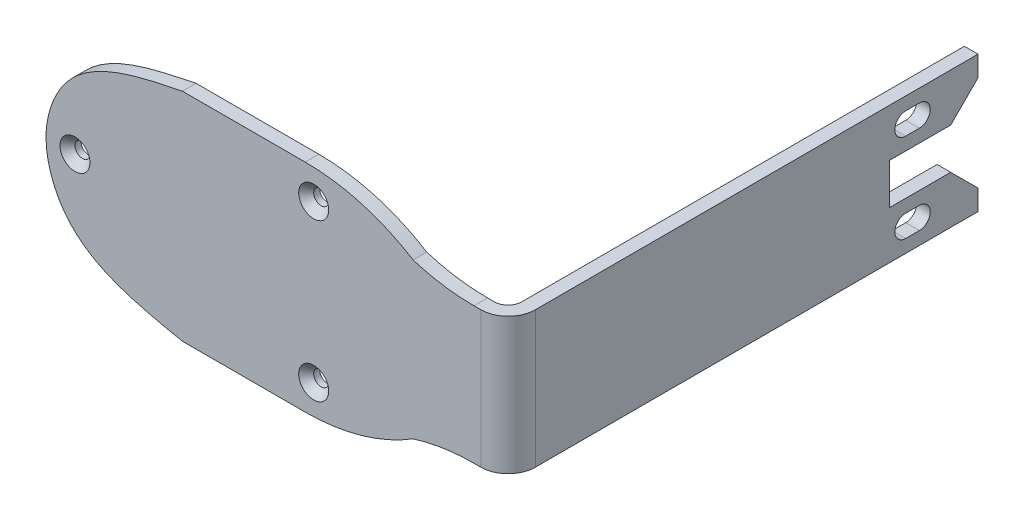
SolidWorks part; units mm, degrees
ref_plane "Face" through (0, 0, 0) normal (0, 0, 1) x (1, 0, 0)
ref_plane "Dessus" through (0, 0, 0) normal (0, 1, 0) x (1, 0, 0)
ref_plane "Droite" through (0, 0, 0) normal (1, 0, 0) x (0, 0, -1)
sketch "Esquisse1" plane through (0, 0, 0) normal (0, 0, 1) x (1, 0, 0)
  line L0 (-170.0705, 12.111) -> (-178.0705, 12.111)
  line L1 (-135.3205, 17.986) -> (-140.3138, 17.986)
  line L2 (-170.0705, 43.861) -> (-178.0705, 43.861)
  line L4 (-32.3132, 27.986) -> (-241.3155, 27.986) construction
  line L5 (-165.0705, 12.111) -> (-170.0705, 12.111)
  line L7 (-203.0705, 27.986) -> (-203.0705, 52.7894) construction
  line L10 (-183.0705, 43.861) -> (-178.0705, 43.861)
  line L12 (-183.0705, 12.111) -> (-178.0705, 12.111)
  line L13 (-135.3205, 37.986) -> (-135.3205, 17.986)
  line L18 (-165.0705, 43.861) -> (-170.0705, 43.861)
  line L21 (-135.3205, 37.986) -> (-140.3138, 37.986)
  arc A0 (-140.3138, 17.986) -> (-149.2415, 16.6268) centre (-140.3138, -12.014) ccw
  arc A1 (-149.2415, 16.6268) -> (-165.0705, 12.111) centre (-165.0705, 42.111) cw
  arc A2 (-149.2415, 39.3452) -> (-165.0705, 43.861) centre (-165.0705, 13.861) ccw
  arc A3 (-140.3138, 37.986) -> (-149.2415, 39.3452) centre (-140.3138, 67.986) cw
  point P11 (-200.4537, 19.986)
  point P21 (-200.4537, 35.986)
  dimension "D2" = 67.75
  dimension "D4" = 10
  dimension "D15" = 30
  dimension "D16" = 30
  dimension "D3" = 15.875
  dimension "D8" = 5
  dimension "D9" = 8
  dimension "D10" = 5
  dimension "D14" = 20
extrude "Base-Extrusion" add sketch "Esquisse1" along normal blind 2
sketch "Esquisse13" plane through (0, 37.986, 0) normal (0, 1, 0) x (-1, 0, 0)
  line L0 (135.3205, 2) -> (140.3138, 2) construction
  line L1 (137.3205, 2) -> (135.3205, 2)
  line L2 (137.3205, 2) -> (137.3205, -66.9)
  line L3 (137.3205, -66.9) -> (135.3205, -66.9)
  line L4 (135.3205, 2) -> (135.3205, -66.9)
  dimension "D1" = 68.9
  dimension "D2" = 2
  dimension "D3" = 67.75
extrude "Boss.-Extru.1" add sketch "Esquisse13" against normal blind 20
fillet "Congé1" radius 4
fillet "Congé2" radius 2
sketch "Esquisse8" plane through (-135.3205, 0, 135.3205) normal (1, 0, 0) x (0, 0, -1)
  line L0 (202.2205, 34.986) -> (198.2205, 30.986)
  line L1 (191.6205, 23.086) -> (193.6205, 23.086)
  line L2 (189.2205, 30.986) -> (189.2205, 24.986)
  line L3 (191.6205, 19.886) -> (193.6205, 19.886)
  line L4 (189.2205, 24.986) -> (198.2205, 24.986)
  line L5 (191.6205, 36.086) -> (193.6205, 36.086)
  line L6 (198.2205, 24.986) -> (202.2205, 20.986)
  line L7 (191.6205, 32.886) -> (193.6205, 32.886)
  line L8 (202.2205, 17.986) -> (202.2205, 37.986) construction
  line L9 (137.3205, 37.986) -> (202.2205, 37.986) construction
  line L10 (202.2205, 20.986) -> (202.2205, 34.986)
  line L12 (198.2205, 30.986) -> (189.2205, 30.986)
  line L13 (137.3205, 17.986) -> (202.2205, 17.986) construction
  arc A0 (193.6205, 23.086) -> (193.6205, 19.886) centre (193.6205, 21.486) cw
  arc A1 (191.6205, 23.086) -> (191.6205, 19.886) centre (191.6205, 21.486) ccw
  arc A2 (193.6205, 36.086) -> (193.6205, 32.886) centre (193.6205, 34.486) cw
  arc A3 (191.6205, 36.086) -> (191.6205, 32.886) centre (191.6205, 34.486) ccw
  dimension "D1" = 1.6
  dimension "D3" = 8.6
  dimension "D4" = 3.5
  dimension "D5" = 8.6
  dimension "D6" = 3.5
  dimension "D7" = 6
  dimension "D2" = 2
  dimension "D8" = 7
  dimension "D9" = 45
  dimension "D10" = 45
  dimension "D11" = 9
  dimension "D12" = 13
extrude "Enlèv. mat.-Extru.1" cut sketch "Esquisse8" against normal through all
hole_wizard "Fraisage pour vis à tête fraisée à fond plat M24" positions "Esquisse20" profile "Esquisse19" countersink size "M2" standard "ISO"
sketch "Esquisse20" plane through (0, 0, 2) normal (0, 0, 1) x (1, 0, 0)
  line L0 (-32.3132, 27.986) -> (-241.3155, 27.986) construction
  point P0 (-198.8205, 27.986)
  dimension "D1" = 4.25
sketch "Esquisse19" plane through (-198.8205, 27.986, 2) normal (1, 0, 0) x (0, -1, 0)
  line L0 (0, 0) -> (0, 10.6609)
  line L1 (0, 10.6609) -> (1.1, 10)
  line L2 (1.1, 10) -> (1.1, 1.1)
  line L3 (1.1, 1.1) -> (2.2, 0)
  line L5 (2.2, 0) -> (0, 0)
  line L6 (-1.1, 1.1) -> (-2.2, 0) construction
  line L10 (0, 10.6609) -> (-1.1, 10) construction
  line L11 (0, -6.35) -> (0, 107.95) construction
  dimension "Diamètre du perçage" = 2.2
  dimension "Profondeur du perçage" = 10
  dimension "Diamètre du fraisage entrant" = 4.4
  dimension "Angle du fraisage entrant" = 90
  dimension "Angle de pointe" = 118
hole_wizard "Fraisage pour vis à tête fraisée à fond plat M25" positions "Esquisse24" profile "Esquisse23" countersink size "M2" standard "ISO"
sketch "Esquisse24" plane through (0, 0, 2) normal (0, 0, 1) x (1, 0, 0)
  line L0 (-32.3132, 27.986) -> (-241.3155, 27.986) construction
  point P0 (-163.8205, 39.486)
  dimension "D1" = 11.5
  dimension "D2" = 35
sketch "Esquisse23" plane through (-163.8205, 39.486, 2) normal (1, 0, 0) x (0, -1, 0)
  line L0 (0, 0) -> (0, 10.6609)
  line L1 (0, 10.6609) -> (1.1, 10)
  line L2 (1.1, 10) -> (1.1, 1.1)
  line L3 (1.1, 1.1) -> (2.2, 0)
  line L5 (2.2, 0) -> (0, 0)
  line L6 (-1.1, 1.1) -> (-2.2, 0) construction
  line L10 (0, 10.6609) -> (-1.1, 10) construction
  line L11 (0, -6.35) -> (0, 107.95) construction
  dimension "Diamètre du perçage" = 2.2
  dimension "Profondeur du perçage" = 10
  dimension "Diamètre du fraisage entrant" = 4.4
  dimension "Angle du fraisage entrant" = 90
  dimension "Angle de pointe" = 118
hole_wizard "Fraisage pour vis à tête fraisée à fond plat M26" positions "Esquisse26" profile "Esquisse25" countersink size "M2" standard "ISO"
sketch "Esquisse26" plane through (0, 0, 2) normal (0, 0, 1) x (1, 0, 0)
  line L0 (-32.3132, 27.986) -> (-241.3155, 27.986) construction
  point P0 (-163.8205, 16.486)
  dimension "D1" = 11.5
  dimension "D2" = 35
sketch "Esquisse25" plane through (-163.8205, 16.486, 2) normal (1, 0, 0) x (0, -1, 0)
  line L0 (0, 0) -> (0, 10.6609)
  line L1 (0, 10.6609) -> (1.1, 10)
  line L2 (1.1, 10) -> (1.1, 1.1)
  line L3 (1.1, 1.1) -> (2.2, 0)
  line L5 (2.2, 0) -> (0, 0)
  line L6 (-1.1, 1.1) -> (-2.2, 0) construction
  line L10 (0, 10.6609) -> (-1.1, 10) construction
  line L11 (0, -6.35) -> (0, 107.95) construction
  dimension "Diamètre du perçage" = 2.2
  dimension "Profondeur du perçage" = 10
  dimension "Diamètre du fraisage entrant" = 4.4
  dimension "Angle du fraisage entrant" = 90
  dimension "Angle de pointe" = 118
